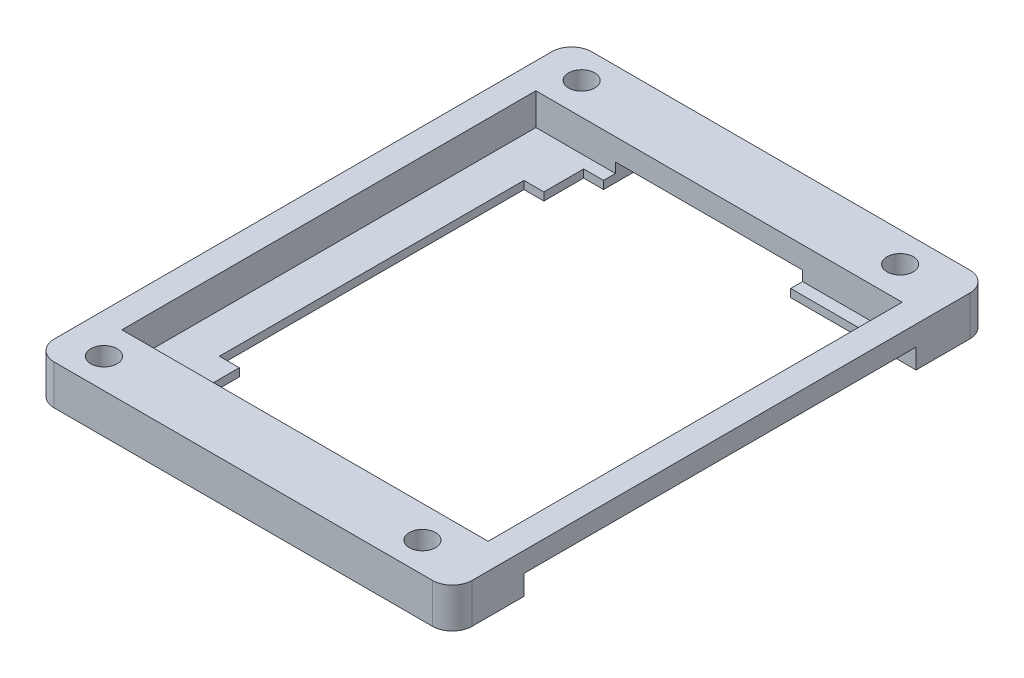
SolidWorks part; units mm, degrees
ref_plane "Front Plane" through (0, 0, 0) normal (0, 0, 1) x (1, 0, 0)
ref_plane "Top Plane" through (0, 0, 0) normal (0, 1, 0) x (1, 0, 0)
ref_plane "Right Plane" through (0, 0, 0) normal (1, 0, 0) x (0, 0, -1)
sketch "Sketch1" plane through (0, 0, 0) normal (0, 1, 0) x (1, 0, 0)
  line L0 (-42.5, -60) -> (37.5, -60) construction
  line L1 (-46, -52) -> (46, -52)
  line L2 (-46, -52) -> (-46, 52)
  line L3 (-46, 52) -> (46, 52)
  line L4 (46, -52) -> (46, 52)
  line L5 (-46, -52) -> (46, 52) construction
  line L6 (-46, 52) -> (46, -52) construction
  line L11 (37.5, -60) -> (37.5, 60) construction
  line L13 (-52.5, -67.5) -> (52.5, -67.5)
  line L14 (-52.5, -67.5) -> (-52.5, 67.5)
  line L15 (-52.5, 67.5) -> (52.5, 67.5)
  line L16 (52.5, -67.5) -> (52.5, 67.5)
  line L17 (-52.5, -67.5) -> (52.5, 67.5) construction
  line L18 (-52.5, 67.5) -> (52.5, -67.5) construction
  circle A0 centre (-42.5, 60) radius 3.3
  circle A1 centre (37.5, 60) radius 3.3
  circle A2 centre (-42.5, -60) radius 3.3
  circle A3 centre (37.5, -60) radius 3.3
  point P0 (0, 0)
  point P6 (0, 0)
  point P15 (0, 0)
  dimension "D5" = 6.6
  dimension "D6" = 6.6
  dimension "D7" = 6.6
  dimension "D8" = 6.6
  dimension "D13" = 10
  dimension "D1" = 92
  dimension "D2" = 104
  dimension "D3" = 120
  dimension "D4" = 80
  dimension "D9" = 105
  dimension "D10" = 135
  dimension "D11" = 80
  dimension "D12" = 120
extrude "Boss-Extrude1" add sketch "Sketch1" along normal blind 10
sketch "Sketch2" plane through (0, 0, 0) normal (0, 1, 0) x (1, 0, 0)
  line L0 (-46, -52) -> (46, -52) construction
  line L1 (-46, 52) -> (-36, 52)
  line L2 (-46, 52) -> (-46, -52)
  line L3 (-46, -52) -> (-36, -52)
  line L4 (-36, 49) -> (-36, -49.5)
  line L5 (46, -52) -> (46, 52) construction
  line L6 (-46, 52) -> (-26, 52)
  line L7 (-46, 52) -> (-46, 49)
  line L8 (-36, 49) -> (-26, 49)
  line L9 (-26, 52) -> (-26, 49)
  line L10 (46, 52) -> (21, 52)
  line L11 (46, 52) -> (46, 49)
  line L12 (46, 49) -> (21, 49)
  line L13 (21, 52) -> (21, 49)
  line L14 (-46, -52) -> (46, -52)
  line L15 (-46, -52) -> (-46, -49.5)
  line L16 (-36, -49.5) -> (41, -49.5)
  line L17 (46, -52) -> (46, -50)
  line L19 (46, -52) -> (39.0635, -52)
  line L20 (46, -52) -> (46, -48.5)
  line L21 (46, -48.5) -> (41, -48.5)
  line L22 (41, -49.5) -> (41, -48.5)
  dimension "D1" = 10
  dimension "D2" = 20
  dimension "D3" = 3
  dimension "D4" = 25
  dimension "D5" = 3
  dimension "D6" = 2
  dimension "D7" = 5
  dimension "D8" = 4
sketch "Sketch3" plane through (0, 0, 0) normal (0, 1, 0) x (1, 0, 0)
  line L0 (-26, 52) -> (-46, 52)
  line L1 (-46, 52) -> (-46, -52)
  line L2 (-46, -52) -> (46, -52)
  line L3 (46, -52) -> (46, -49.5)
  line L6 (41, -49.5) -> (-31, -49.5)
  line L7 (-36, -37.5) -> (-36, 39)
  line L8 (-31, 49) -> (-26, 49)
  line L9 (-26, 49) -> (-26, 52)
  line L10 (21, 52) -> (21, 49)
  line L11 (21, 49) -> (46, 49)
  line L12 (46, 49) -> (46, 52)
  line L13 (46, 52) -> (21, 52)
  line L14 (41, -49.5) -> (46, -49.5)
  line L17 (-36, -37.5) -> (-31, -37.5)
  line L18 (-31, -49.5) -> (-31, -37.5)
  line L21 (-36, 39) -> (-31, 39)
  line L22 (-31, 49) -> (-31, 39)
  dimension "D1" = 12
  dimension "D2" = 5
  dimension "D3" = 5
  dimension "D4" = 10
extrude "Boss-Extrude2" add sketch "Sketch3" along normal blind 2
sketch "Sketch4" plane through (0, 10, 0) normal (0, 1, 0) x (1, 0, 0)
  line L0 (52.5, -67.5) -> (52.5, 67.5) construction
  line L1 (46, 49) -> (52.5, 49)
  line L2 (46, 49) -> (46, -49.5157)
  line L3 (46, -49.5157) -> (52.5, -49.5157)
  line L4 (52.5, 49) -> (52.5, -49.5157)
extrude "Cut-Extrude1" cut sketch "Sketch4" along normal blind 4.5 and the other way through all from offset 9.5
sketch "Sketch5" plane through (0, 0, 0) normal (0, -1, 0) x (-1, 0, 0)
  line L0 (-52.5, 67.5) -> (52.5, 67.5) construction
  line L1 (26, 52) -> (-21, 52)
  line L2 (26, 52) -> (26, 67.5)
  line L3 (26, 67.5) -> (-21, 67.5)
  line L4 (-21, 52) -> (-21, 67.5)
extrude "Cut-Extrude2" cut sketch "Sketch5" against normal blind 4.5 and the other way through all
fillet "Fillet1" radius 5 4 edges at (52.5, 5, 67.5) (-52.5, 5, 67.5) (-52.5, 5, -67.5) (52.5, 5, -67.5)
